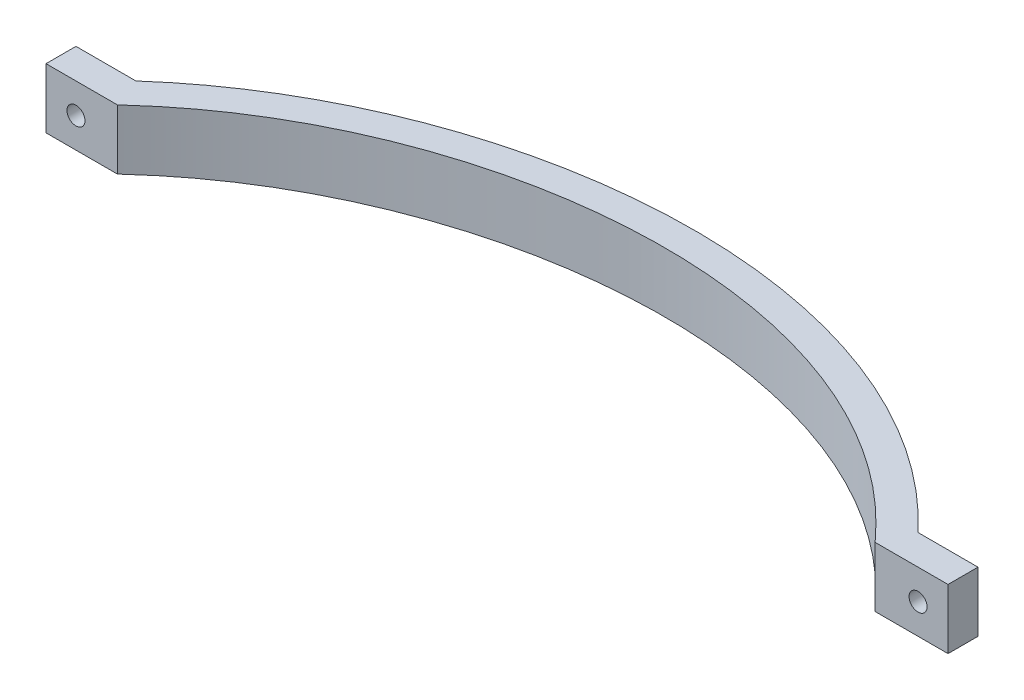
SolidWorks part; units mm, degrees
ref_plane "Front Plane" through (0, 0, 0) normal (0, 0, 1) x (1, 0, 0)
ref_plane "Top Plane" through (0, 0, 0) normal (0, 1, 0) x (1, 0, 0)
ref_plane "Right Plane" through (0, 0, 0) normal (1, 0, 0) x (0, 0, -1)
sketch "Sketch1" plane through (0, 0, 0) normal (0, 1, 0) x (1, 0, 0)
  line L0 (-64.8466, 0) -> (-54.8466, 0)
  line L1 (-64.8466, -5) -> (-52.9436, -5)
  line L2 (75.6357, 0) -> (85.6357, 0)
  line L3 (73.4792, -5) -> (85.6357, -5)
  line L4 (-64.8466, 0) -> (-64.8466, -5)
  line L5 (85.6357, -5) -> (85.6357, 0)
  spline S0 degree 3 poles (-54.8466, 0) (-19.978, 31.0371) (42.024, 35.6186) (75.6357, 0) knots 0 0 0 0 1 1 1 1
  spline S1 degree 1 poles (-52.9436, -5) (73.4792, -5) knots 0 0 1 1 construction
  spline S2 degree 3 poles (-52.9436, -5) (-52.3884, -4.5058) (-51.5329, -3.7383) (-50.4815, -2.8209) (-48.856, -1.441) (-45.2428, 1.4336) (-39.3008, 5.4797) (-31.6645, 9.6862) (-20.9168, 14.3993) (-6.6483, 18.5419) (11.0808, 20.5241) (28.6834, 19.3562) (42.6484, 15.6497) (53.0627, 10.9887) (59.1921, 7.3563) (63.8317, 4.0087) (66.6136, 1.7304) (68.7655, -0.2069) (70.0757, -1.463) (71.1104, -2.5025) (72.1083, -3.5403) (72.9423, -4.4311) (73.4792, -5) knots -0.013588 -0.013588 -0.013588 -0.013588 0.002478 0.010512 0.018545 0.050678 0.114945 0.179212 0.243478 0.372011 0.500545 0.629078 0.757611 0.821878 0.886144 0.918278 0.950411 0.966478 0.982544 0.990578 0.998611 1.014678 1.014678 1.014678 1.014678
  dimension "D1" = 5
extrude "Boss-Extrude1" add sketch "Sketch1" along normal blind 10
sketch "Sketch2" plane through (0, 0, 0) normal (0, 0, -1) x (-1, 0, 0)
  circle A0 centre (59.8466, 5) radius 1.5
  circle A1 centre (-80.6357, 5) radius 1.5
extrude "Cut-Extrude1" cut sketch "Sketch2" against normal blind 5
